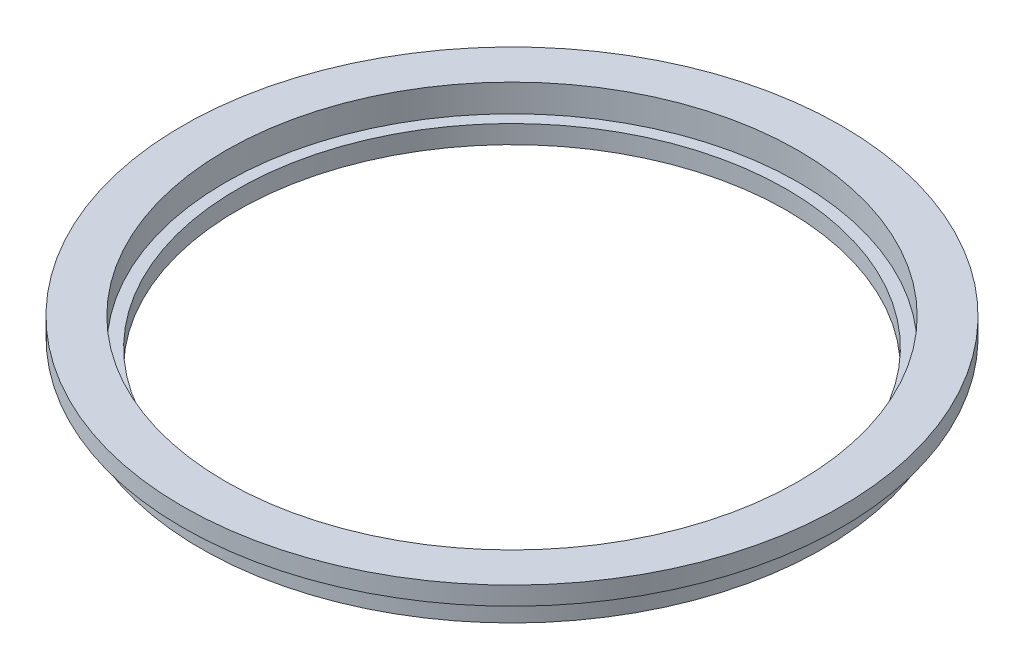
SolidWorks part; units mm, degrees
ref_plane "Front Plane" through (0, 0, 0) normal (0, 0, 1) x (1, 0, 0)
ref_plane "Top Plane" through (0, 0, 0) normal (0, 1, 0) x (1, 0, 0)
ref_plane "Right Plane" through (0, 0, 0) normal (1, 0, 0) x (0, 0, -1)
sketch "Sketch1" plane through (0, 0, 0) normal (0, 1, 0) x (1, 0, 0)
  circle A0 centre (0, 0) radius 18
  dimension "D1" = 36
extrude "Boss-Extrude1" add sketch "Sketch1" along normal mid plane 2.5
sketch "Sketch2" plane through (0, 1.25, 0) normal (0, 1, 0) x (1, 0, 0)
  circle A0 centre (0, 0) radius 15.65
  dimension "D1" = 31.3
extrude "Cut-Extrude1" cut sketch "Sketch2" against normal blind 1.5
sketch "Sketch4" plane through (0, -0.25, 0) normal (0, 1, 0) x (1, 0, 0)
  circle A0 centre (0, 0) radius 15
  dimension "D1" = 30
extrude "Cut-Extrude2" cut sketch "Sketch4" against normal up to next contours A0
sketch "Sketch5" plane through (0, -1.25, 0) normal (0, -1, 0) x (1, 0, 0)
  circle A0 centre (0, 0) radius 17
  circle A1 centre (0, 0) radius 18 construction
  circle A2 centre (0, 0) radius 18
  dimension "D1" = 34
extrude "Cut-Extrude3" cut sketch "Sketch5" against normal blind 1.5 contours A0 | A2
